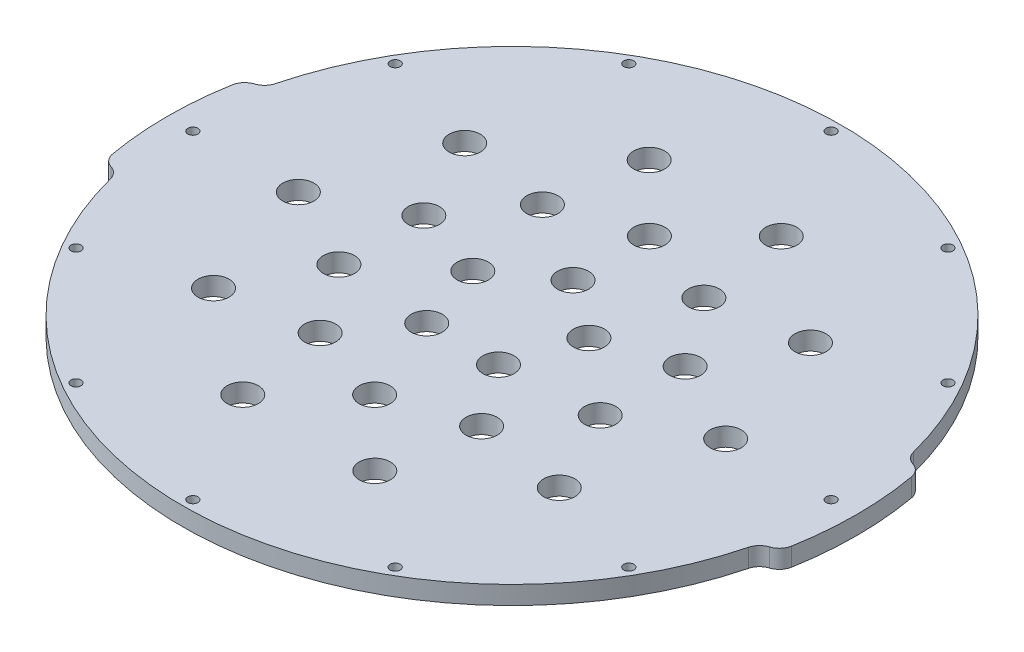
SolidWorks part; units mm, degrees
ref_plane "Front Plane" through (0, 0, 0) normal (0, 0, 1) x (1, 0, 0)
ref_plane "Top Plane" through (0, 0, 0) normal (0, 1, 0) x (1, 0, 0)
ref_plane "Right Plane" through (0, 0, 0) normal (1, 0, 0) x (0, 0, -1)
sketch "Sketch1" plane through (0, 0, 0) normal (0, 1, 0) x (1, 0, 0)
  line L0 (0, 0) -> (-111.234, 19.6136) construction
  line L1 (0, 0) -> (-139.7786, 0) construction
  line L2 (0, 0) -> (-111.234, -19.6136) construction
  line L3 (0, 0) -> (111.234, 19.6136) construction
  line L4 (0, 0) -> (111.234, -19.6136) construction
  circle A0 centre (0, 0) radius 104.55 construction
  circle A1 centre (0, 104.55) radius 1.65
  circle A2 centre (52.275, 90.543) radius 1.65
  circle A3 centre (90.543, 52.275) radius 1.65
  circle A4 centre (104.55, 0) radius 1.65
  circle A5 centre (90.543, -52.275) radius 1.65
  circle A6 centre (52.275, -90.543) radius 1.65
  circle A7 centre (0, -104.55) radius 1.65
  circle A8 centre (-52.275, -90.543) radius 1.65
  circle A9 centre (-90.543, -52.275) radius 1.65
  circle A10 centre (-104.55, 0) radius 1.65
  circle A11 centre (-90.543, 52.275) radius 1.65
  circle A12 centre (-52.275, 90.543) radius 1.65
  circle A13 centre (0, 0) radius 107.95 construction
  circle A14 centre (0, 0) radius 112.95 construction
  arc A15 (-111.234, -19.6136) -> (-111.234, 19.6136) centre (0, 0) cw
  arc A16 (111.234, -19.6136) -> (111.234, 19.6136) centre (0, 0) ccw
  arc A17 (-111.234, -19.6136) -> (-105.328, -23.6479) centre (-106.31, -18.7453) ccw
  arc A18 (-111.234, 19.6136) -> (-105.328, 23.6479) centre (-106.31, 18.7453) cw
  arc A19 (111.234, -19.6136) -> (105.328, -23.6479) centre (106.31, -18.7453) cw
  arc A20 (111.234, 19.6136) -> (105.328, 23.6479) centre (106.31, 18.7453) ccw
  arc A21 (-105.328, 23.6479) -> (105.328, 23.6479) centre (0, 0) cw
  arc A22 (105.328, -23.6479) -> (-105.328, -23.6479) centre (0, 0) cw
  point P30 (0, 0)
  dimension "D1" = 3.3
  dimension "D2" = 209.1
  dimension "D4" = 215.9
  dimension "D5" = 5
  dimension "D6" = 10
  dimension "D3" = 12
extrude "Boss-Extrude1" add sketch "Sketch1" along normal blind 6
fillet "Fillet1" radius 5 4 edges at (105.328, 3, 23.6479) (105.328, 3, -23.6479) (-105.328, 3, -23.6479) (-105.328, 3, 23.6479)
sketch "Sketch2" plane through (0, 6, 0) normal (0, 1, 0) x (1, 0, 0)
  line L0 (0, 0) -> (0, -107.95) construction
  line L1 (0, 0) -> (11.7557, -16.1803) construction
  line L2 (0, 0) -> (21.6312, -66.574) construction
  circle A0 centre (0, 45) radius 5.1
  circle A1 centre (0, 0) radius 45 construction
  circle A2 centre (26.4503, 36.4058) radius 5.1
  circle A3 centre (42.7975, 13.9058) radius 5.1
  circle A4 centre (42.7975, -13.9058) radius 5.1
  circle A5 centre (26.4503, -36.4058) radius 5.1
  arc A6 (-104.514, -27.019) -> (104.514, -27.019) centre (0, 0) ccw construction
  circle A7 centre (0, -45) radius 5.1
  circle A8 centre (-26.4503, -36.4058) radius 5.1
  circle A9 centre (-42.7975, -13.9058) radius 5.1
  circle A10 centre (-42.7975, 13.9058) radius 5.1
  circle A11 centre (-26.4503, 36.4058) radius 5.1
  circle A12 centre (0, 0) radius 20 construction
  circle A13 centre (11.7557, -16.1803) radius 5.1
  circle A14 centre (-11.7557, -16.1803) radius 5.1
  circle A15 centre (-19.0211, 6.1803) radius 5.1
  circle A16 centre (0, 20) radius 5.1
  circle A17 centre (19.0211, 6.1803) radius 5.1
  circle A18 centre (0, 0) radius 89 construction
  circle A19 centre (0, 0) radius 70 construction
  circle A20 centre (21.6312, -66.574) radius 5.1
  circle A21 centre (-21.6312, -66.574) radius 5.1
  circle A22 centre (-56.6312, -41.145) radius 5.1
  circle A23 centre (-70, 0) radius 5.1
  circle A24 centre (-56.6312, 41.145) radius 5.1
  circle A25 centre (-21.6312, 66.574) radius 5.1
  circle A26 centre (21.6312, 66.574) radius 5.1
  circle A27 centre (56.6312, 41.145) radius 5.1
  circle A28 centre (70, 0) radius 5.1
  circle A29 centre (56.6312, -41.145) radius 5.1
  circle A30 centre (-21.6312, -66.574) radius 10 construction
  circle A31 centre (-26.4503, -36.4058) radius 10 construction
  circle A32 centre (-11.7557, -16.1803) radius 10 construction
  circle A33 centre (11.7557, -16.1803) radius 10 construction
  point P5 (0, -45)
  point P16 (0, 0)
  point P43 (0, 0)
  point P66 (0, 0)
  dimension "D1" = 10.2
  dimension "D3" = 90
  dimension "D4" = 40
  dimension "D5" = 5
  dimension "D7" = 178
  dimension "D10" = 140
  dimension "D11" = 20
  dimension "D6" = 36
  dimension "D8" = 18
  dimension "D2" = 10
  dimension "D9" = 10
extrude "Cut-Extrude1" cut sketch "Sketch2" against normal through all
